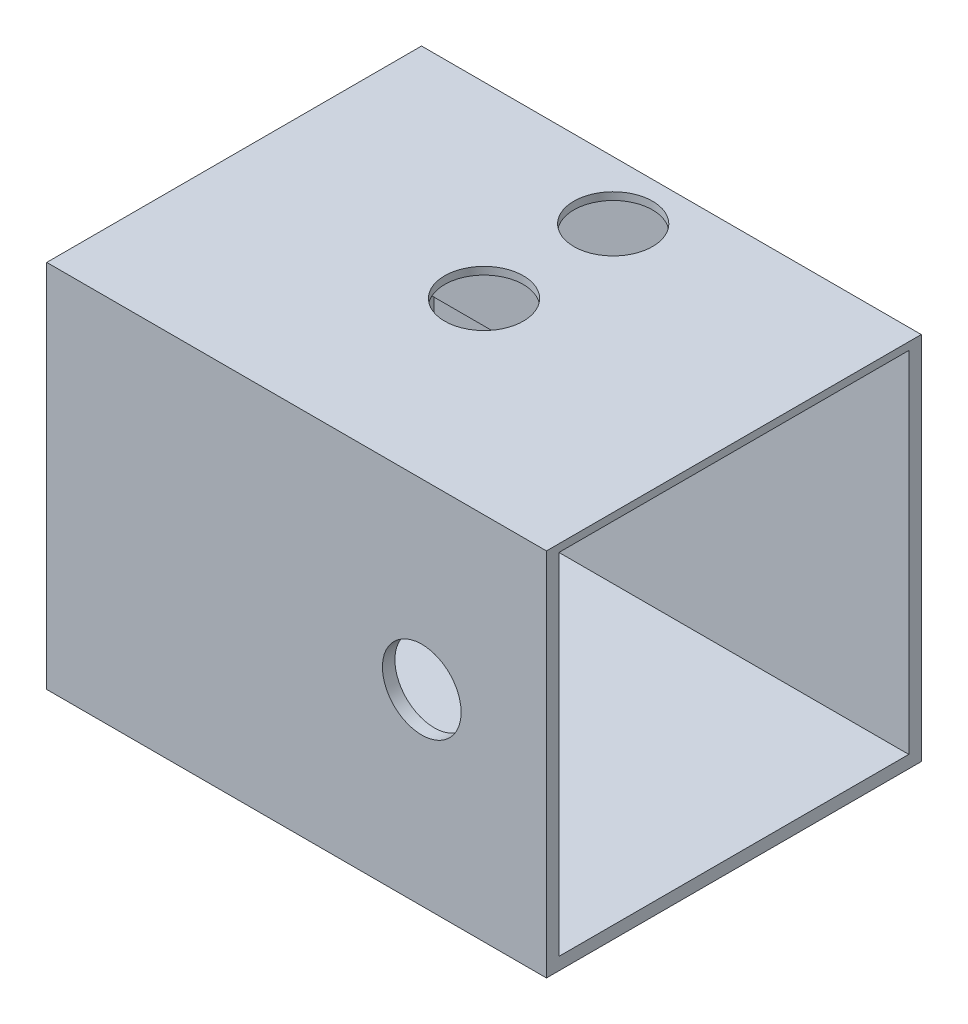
SolidWorks part; units mm, degrees
ref_plane "Front Plane" through (0, 0, 0) normal (0, 0, 1) x (1, 0, 0)
ref_plane "Top Plane" through (0, 0, 0) normal (0, 1, 0) x (1, 0, 0)
ref_plane "Right Plane" through (0, 0, 0) normal (1, 0, 0) x (0, 0, -1)
sketch "Sketch1" plane through (0, 0, 0) normal (0, 0, 1) x (1, 0, 0)
  line L1 (-25.4, 19.05) -> (25.4, 19.05)
  line L2 (-25.4, 19.05) -> (-25.4, -19.05)
  line L3 (-25.4, -19.05) -> (25.4, -19.05)
  line L4 (25.4, 19.05) -> (25.4, -19.05)
  line L5 (-25.4, 19.05) -> (25.4, -19.05) construction
  line L6 (-25.4, -19.05) -> (25.4, 19.05) construction
  point P0 (0, 0)
extrude "Boss-Extrude2" add sketch "Sketch1" along normal blind 38.1
sketch "Sketch3" plane through (25.4, 0, 0) normal (1, 0, 0) x (0, 0, -1)
  line L0 (-19.05, 19.05) -> (-19.05, -19.05)
  line L1 (-38.1, 19.05) -> (0, 19.05) construction
  line L2 (-38.1, -19.05) -> (0, -19.05) construction
  line L3 (-38.1, 0) -> (0, 0)
  line L4 (-38.1, -19.05) -> (-38.1, 19.05) construction
  line L6 (-36.83, 17.78) -> (-1.27, 17.78)
  line L7 (-36.83, 17.78) -> (-36.83, -17.78)
  line L8 (-36.83, -17.78) -> (-1.27, -17.78)
  line L9 (-1.27, 17.78) -> (-1.27, -17.78)
  line L10 (-36.83, 17.78) -> (-1.27, -17.78) construction
  line L11 (-36.83, -17.78) -> (-1.27, 17.78) construction
  point P11 (-19.05, 0)
extrude "Cut-Extrude1" cut sketch "Sketch3" against normal blind 48.26 contours L6 L7 L3 L0 | L9 L6 L0 L3 | L9 L3 L0 L8 | L7 L8 L0 L3
sketch "Sketch4" plane through (0, 19.05, 0) normal (0, 1, 0) x (1, 0, 0)
  line L0 (0, 0) -> (0, -38.1)
  line L1 (25.4, -38.1) -> (-25.4, -38.1) construction
  line L2 (-25.4, -19.05) -> (25.4, -19.05)
  line L3 (-25.4, -38.1) -> (-25.4, 0) construction
  line L4 (25.4, -38.1) -> (25.4, 0) construction
  circle A0 centre (0, -19.05) radius 4
extrude "Cut-Extrude2" cut sketch "Sketch4" against normal blind 10 contours A0
sketch "Sketch5" plane through (0, 19.05, 0) normal (0, 1, 0) x (1, 0, 0)
  line L1 (-6.9804, -2.1866) -> (7.0196, -2.1866)
  line L2 (-6.9804, -2.1866) -> (-6.9804, -10.1866)
  line L3 (-6.9804, -10.1866) -> (7.0196, -10.1866)
  line L4 (7.0196, -2.1866) -> (7.0196, -10.1866)
  line L5 (-6.9804, -2.1866) -> (7.0196, -10.1866) construction
  line L6 (-6.9804, -10.1866) -> (7.0196, -2.1866) construction
  point P0 (0.0196, -6.1866)
extrude "Cut-Extrude3" cut sketch "Sketch5" against normal blind 10
sketch "Sketch6" plane through (0, 0, 38.1) normal (0, 0, 1) x (1, 0, 0)
  circle A0 centre (12.723, 0) radius 4
extrude "Cut-Extrude4" cut sketch "Sketch6" against normal blind 10
sketch "Sketch8" plane through (-22.86, 0, 0) normal (1, 0, 0) x (0, 0, -1)
  line L0 (-36.83, 17.78) -> (-1.27, 17.78) construction
  line L1 (-23.8973, 17.78) -> (-25.8973, 17.78)
  line L2 (-23.8973, 17.78) -> (-23.8973, 11.6249)
  line L3 (-23.8973, 11.6249) -> (-25.8973, 11.6249)
  line L4 (-25.8973, 17.78) -> (-25.8973, 11.6249)
  line L6 (-14.702, 17.78) -> (-12.702, 17.78)
  line L7 (-14.702, 17.78) -> (-14.702, 11.78)
  line L8 (-14.702, 11.78) -> (-12.702, 11.78)
  line L9 (-12.702, 17.78) -> (-12.702, 11.78)
extrude "Boss-Extrude3" add sketch "Sketch8" along normal blind 42 contours L9 L7 L8 M8 | L2 L1 L4 L3
sketch "Sketch9" plane through (0, 19.05, 0) normal (0, 1, 0) x (1, 0, 0)
  line L1 (-25.4, 0) -> (25.4, 0)
  line L2 (-25.4, 0) -> (-25.4, -38.1)
  line L3 (-25.4, -38.1) -> (25.4, -38.1)
  line L4 (25.4, 0) -> (25.4, -38.1)
extrude "Cut-Extrude5" cut sketch "Sketch9" against normal blind 0.5
sketch "Sketch10" plane through (-6.9804, 0, 0) normal (1, 0, 0) x (0, 0, -1)
  line L0 (-36.83, 17.78) -> (-1.27, 17.78) construction
  line L1 (0, 18.55) -> (-11.2251, 18.55)
  line L2 (0, 18.55) -> (0, 17.78)
  line L3 (0, 17.78) -> (-11.2251, 17.78)
  line L4 (-11.2251, 18.55) -> (-11.2251, 17.78)
extrude "Boss-Extrude4" add sketch "Sketch10" along normal blind 17.5 contours L2 L1 L4 L3
sketch "Sketch11" plane through (0, 18.55, 0) normal (0, 1, 0) x (1, 0, 0)
  circle A0 centre (0, -5.9157) radius 4
extrude "Cut-Extrude6" cut sketch "Sketch11" against normal blind 17.5 contours A0
